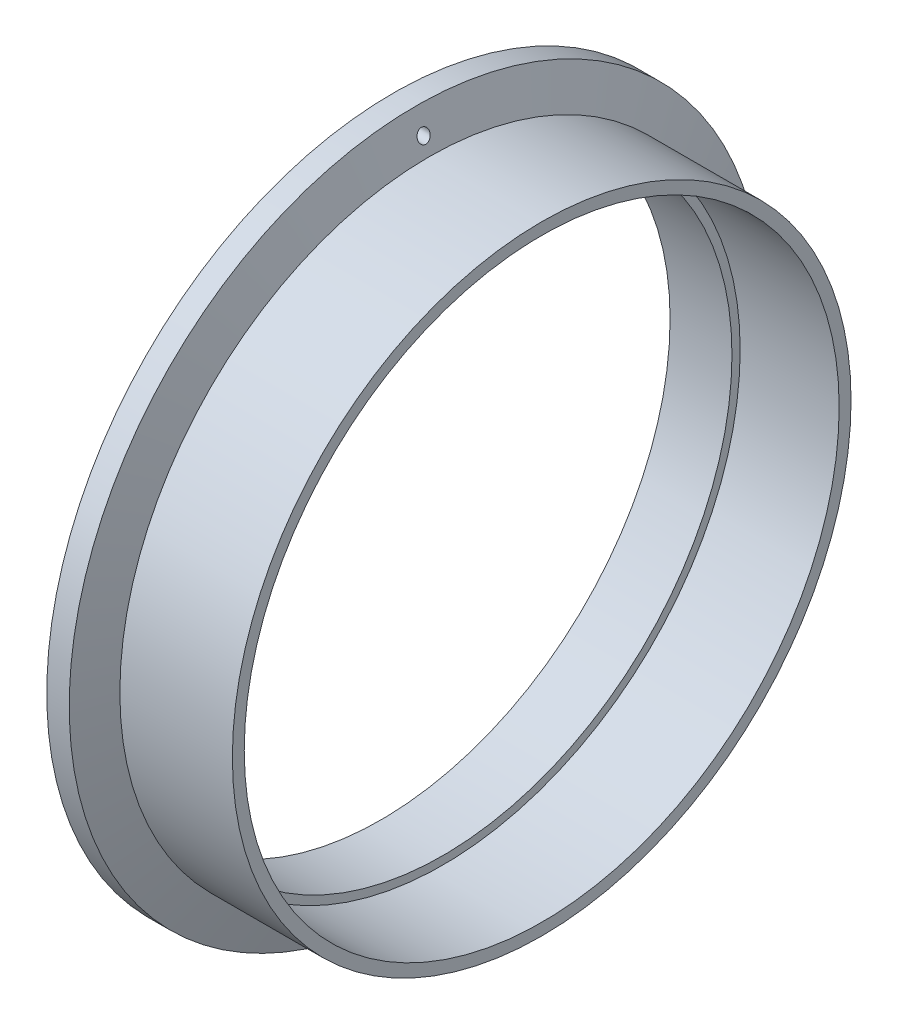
SolidWorks part; units mm, degrees
ref_plane "Front" through (0, 0, 0) normal (0, 0, 1) x (1, 0, 0)
ref_plane "Top" through (0, 0, 0) normal (0, 1, 0) x (1, 0, 0)
ref_plane "Right" through (0, 0, 0) normal (1, 0, 0) x (0, 0, -1)
sketch "Sketch1" plane through (0, 0, 0) normal (0, 0, 1) x (1, 0, 0)
  line L0 (38.1, 79.375) -> (9.2326, 79.375)
  line L1 (9.2326, 79.375) -> (5.7658, 88.9)
  line L2 (5.7658, 88.9) -> (0, 88.9)
  line L3 (0, 88.9) -> (0, 80.137)
  line L4 (-3.175, 74.2188) -> (12.7, 74.2188)
  line L5 (38.1, 76.327) -> (38.1, 79.375)
  line L6 (24.33, 0) -> (0, 0) construction
  line L7 (38.1, 76.327) -> (12.7, 76.327)
  line L8 (2.667, 76.073) -> (-2.667, 76.073)
  line L9 (2.667, 76.073) -> (2.667, 80.137)
  line L10 (2.667, 80.137) -> (0, 80.137)
  line L11 (-3.175, 75.565) -> (-3.175, 74.2188)
  line L12 (12.7, 76.327) -> (12.7, 74.2188)
  line L13 (-2.667, 76.073) -> (-3.175, 75.565)
  point P12 (-3.175, 76.073)
  dimension "D2" = 158.75
  dimension "D3" = 38.1
  dimension "D4" = 177.8
  dimension "D5" = 5.7658
  dimension "D6" = 20
  dimension "D7" = 5.1562
  dimension "D8" = 9.525
  dimension "D9" = 152.146
  dimension "D10" = 3.175
  dimension "D11" = 2.667
  dimension "D12" = 4.064
  dimension "D13" = 152.654
  dimension "D14" = 25.4
  dimension "D15" = 2.1082
revolve "Revolve1" add sketch "Sketch1" angle 360 about L6
sketch "Sketch2" plane through (0, 0, 0) normal (-1, 0, 0) x (0, 0, 1)
  circle A0 centre (0, 83.312) radius 1.5875
  dimension "D1" = 3.175
  dimension "D2" = 83.312
extrude "Cut-Extrude1" cut sketch "Sketch2" against normal through all
